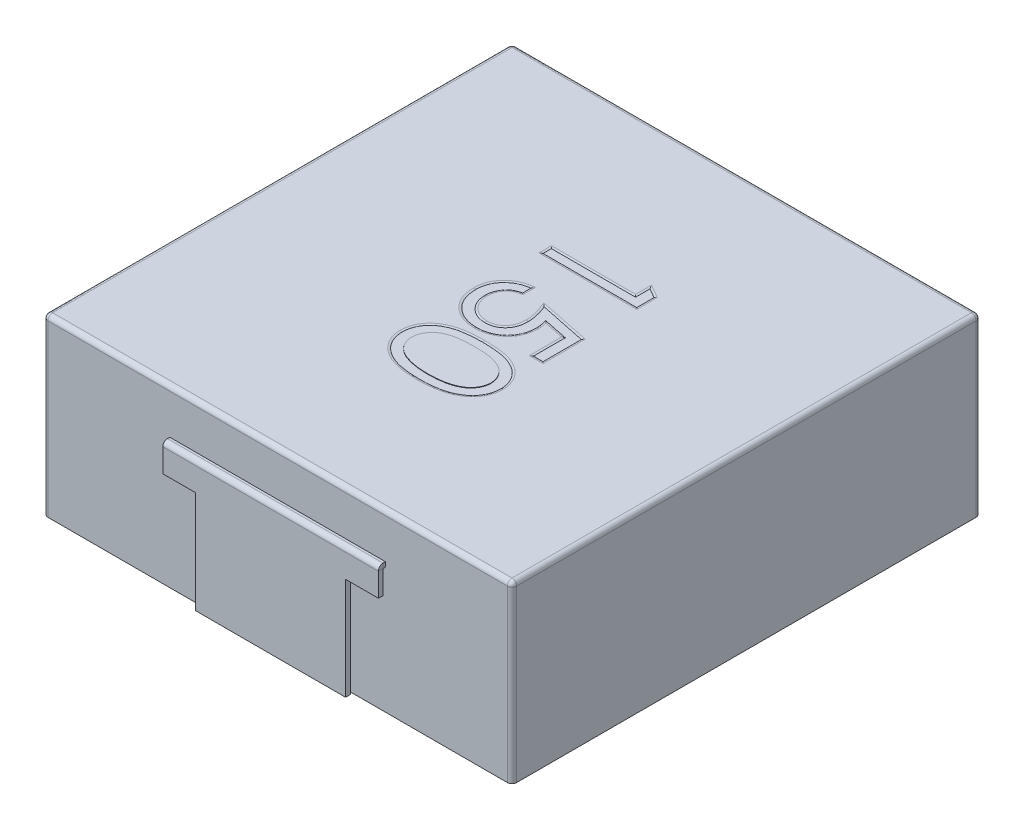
SolidWorks part; units mm, degrees
ref_plane "Front Plane" through (0, 0, 0) normal (0, 0, 1) x (1, 0, 0)
ref_plane "Top Plane" through (0, 0, 0) normal (0, 1, 0) x (1, 0, 0)
ref_plane "Right Plane" through (0, 0, 0) normal (1, 0, 0) x (0, 0, -1)
sketch "Sketch1" plane through (0, 0, 0) normal (0, 1, 0) x (1, 0, 0)
  line L1 (-5, 5) -> (5, 5)
  line L2 (-5, 5) -> (-5, -5)
  line L3 (-5, -5) -> (5, -5)
  line L4 (5, 5) -> (5, -5)
  line L5 (-5, 5) -> (5, -5) construction
  line L6 (-5, -5) -> (5, 5) construction
  point P0 (0, 0)
  dimension "D1" = 10
  dimension "D2" = 10
extrude "MB" add sketch "Sketch1" along normal blind 3.73
sketch "Sketch2" plane through (0, 0, 0) normal (1, 0, 0) x (0, 0, -1)
  line L0 (-5.1, 0) -> (-5.1, 2.68)
  line L1 (-5, 2.73) -> (-5.05, 2.73)
  line L2 (-5, 3.73) -> (-5, 0) construction
  line L3 (-5, 3.73) -> (5, 3.73) construction
  line L4 (-5, 0) -> (5, 0) construction
  arc A0 (-5.05, 2.73) -> (-5.1, 2.68) centre (-5.05, 2.68) ccw
  dimension "D1" = 0.05
  dimension "D2" = 1
  dimension "D3" = 0.1
sketch "Sketch3" plane through (0, 0, 5) normal (0, 0, 1) x (1, 0, 0)
  line L1 (-2.3, 2.68) -> (2.3, 2.68)
  line L2 (-2.3, 2.68) -> (-2.3, 2.78)
  line L3 (-2.3, 2.78) -> (2.3, 2.78)
  line L4 (2.3, 2.68) -> (2.3, 2.78)
  line L5 (-2.3, 2.68) -> (2.3, 2.78) construction
  line L6 (-2.3, 2.78) -> (2.3, 2.68) construction
  point P0 (0, 2.73)
  dimension "D1" = 4.6
  dimension "D2" = 0.1
sweep "FLANGED CONNECTION" add profiles "Sketch3" path "Sketch2"
sketch "Sketch4" plane through (0, 0, 5.15) normal (0, 0, 1) x (1, 0, 0)
  line L0 (2.3, 2.78) -> (-2.3, 2.78) construction
  line L1 (-1.6, 2.18) -> (-2.3, 2.18)
  line L2 (-1.6, 2.18) -> (-1.6, 0)
  line L3 (-1.6, 0) -> (-2.3, 0)
  line L4 (-2.3, 2.18) -> (-2.3, 0)
  dimension "D1" = 0.6
  dimension "D2" = 1.6
extrude "CONNECTION CUT" cut sketch "Sketch4" against normal up to next
mirror "Mirror1" about plane through (0, 0, 0) normal (1, 0, 0) of "CONNECTION CUT"
mirror "Mirror2" about plane through (0, 0, 0) normal (0, 0, 1) of "Mirror1", "CONNECTION CUT", "FLANGED CONNECTION"
sketch "Sketch5" plane through (0, 3.73, 0) normal (0, 1, 0) x (1, 0, 0)
  line L0 (-0.7744, 5) -> (-0.7744, -5) construction
  line L1 (5, 5) -> (-5, 5) construction
  line L2 (-5, -5) -> (5, -5) construction
  text T0 "150  " font "Century Gothic" height 2
extrude "Cut-Extrude2" cut sketch "Sketch5" against normal blind 0.01
fillet "Fillet1" radius 0.1 28 edges at (0, 3.73, 5) (-5, 3.73, 0) (0, 3.73, -5) (5, 3.73, 0) (0.123, 3.73, -1.6154) (-0.7744, 3.73, -1.5256) (0.2256, 3.73, -1.4359) (1.2256, 3.73, -1.6208) (1.123, 3.73, -1.8644) (1.0204, 3.73, -1.7692) (1.0204, 3.73, 0.224) (1.123, 3.73, 0.5641) (0.7574, 3.73, -0.1701) (0.7256, 3.73, -0.359) (-0.2616, 3.73, -0.5769) (1.2256, 3.73, 0.1538)
fillet "Fillet2" radius 0.1 8 edges at (4.9707, 3.7007, -4.9707) (-4.9707, 3.7007, -4.9707) (-4.9707, 3.7007, 4.9707) (4.9707, 3.7007, 4.9707) (5, 1.815, -5) (-5, 1.815, -5) (-5, 1.815, 5) (5, 1.815, 5)
